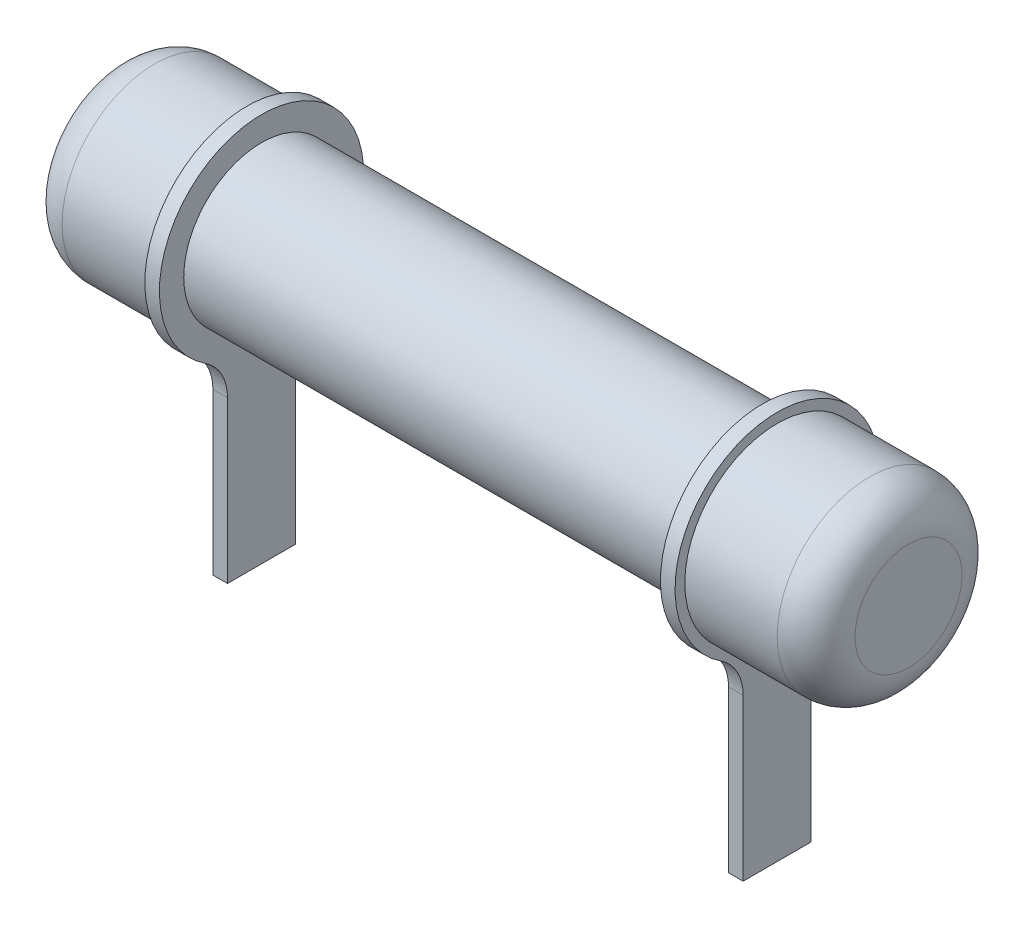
SolidWorks part; units mm, degrees
ref_plane "Front" through (0, 0, 0) normal (0, 0, 1) x (1, 0, 0)
ref_plane "Top" through (0, 0, 0) normal (0, 1, 0) x (1, 0, 0)
ref_plane "Right" through (0, 0, 0) normal (1, 0, 0) x (0, 0, -1)
sketch "Эскиз2" plane through (0, 0, 0) normal (0, 0, 1) x (1, 0, 0)
  line L0 (0, 1.6) -> (0, 2.1)
  line L1 (0, 2.1) -> (-0.3, 2.1)
  line L2 (-0.3, 2.1) -> (-0.3, 1.9)
  line L3 (-0.3, 1.9) -> (-2.2, 1.9)
  line L4 (-3, 1.1) -> (-3, 0)
  line L5 (-3, 0) -> (0, 0) construction
  line L6 (-2, 0) -> (-3, 0)
  line L7 (0, 1.6) -> (-2, 1.6)
  line L8 (-2, 1.6) -> (-2, 0)
  arc A0 (-2.2, 1.9) -> (-3, 1.1) centre (-2.2, 1.1) ccw
  dimension "D5" = 0.8
  dimension "D1" = 3.8
  dimension "D2" = 4.2
  dimension "D3" = 0.3
  dimension "D4" = 3
  dimension "D6" = 3.2
  dimension "D7" = 2
revolve "Повернуть1" add sketch "Эскиз2" angle 360 about L5
ref_plane "Плоскость2" through (0, -1.9, 0) normal (0, 1, 0) x (-1, 0, 0)
sketch "Эскиз6" plane through (0, -1.9, 0) normal (0, 1, 0) x (-1, 0, 0)
  line L0 (0, 2.1) -> (0, -2.1) construction
  line L1 (0, 0.7) -> (0.3, 0.7)
  line L2 (0, 0.7) -> (0, -0.7)
  line L3 (0, -0.7) -> (0.3, -0.7)
  line L4 (0.3, 0.7) -> (0.3, -0.7)
  line L5 (0.3, -2.1) -> (0.3, 2.1) construction
  line L6 (0, 0) -> (0.3, 0) construction
  dimension "D1" = 1.4
sketch "Эскиз7" plane through (0, 0, 0) normal (0, 0, 1) x (1, 0, 0)
  line L0 (-0.15, -1.9) -> (-0.15, -5.9)
  line L1 (0, -1.9) -> (-0.3, -1.9) construction
  dimension "D1" = 4
sweep "По траектории1" add profiles "Эскиз6" path "Эскиз7"
sketch "Эскиз4" plane through (-2, 0, 0) normal (1, 0, 0) x (0, 0, -1)
  circle A0 centre (0, 0) radius 0.15
  circle A1 centre (0, 0) radius 1.3
  circle A2 centre (0, 0) radius 1.6
  circle A3 centre (0, 0) radius 1.6 construction
  dimension "D1" = 2.6
  dimension "D2" = 0.3
extrude "Вытянуть2" add sketch "Эскиз4" along normal blind 7.75
ref_plane "Плоскость1" through (5.15, 0, 0) normal (1, 0, 0) x (0, 0, -1)
mirror "Зеркальное отражение7" about plane through (5.15, 0, 0) normal (1, 0, 0) of "Вытянуть2"
mirror "Зеркальное отражение9" about plane through (5.15, 0, 0) normal (1, 0, 0) of "По траектории1", "Повернуть1"
fillet "Скругление3" radius 1 4 edges at (-0.15, -1.9799, -0.7) (10.45, -1.9799, -0.7) (10.45, -1.9799, 0.7) (-0.15, -1.9799, 0.7)
